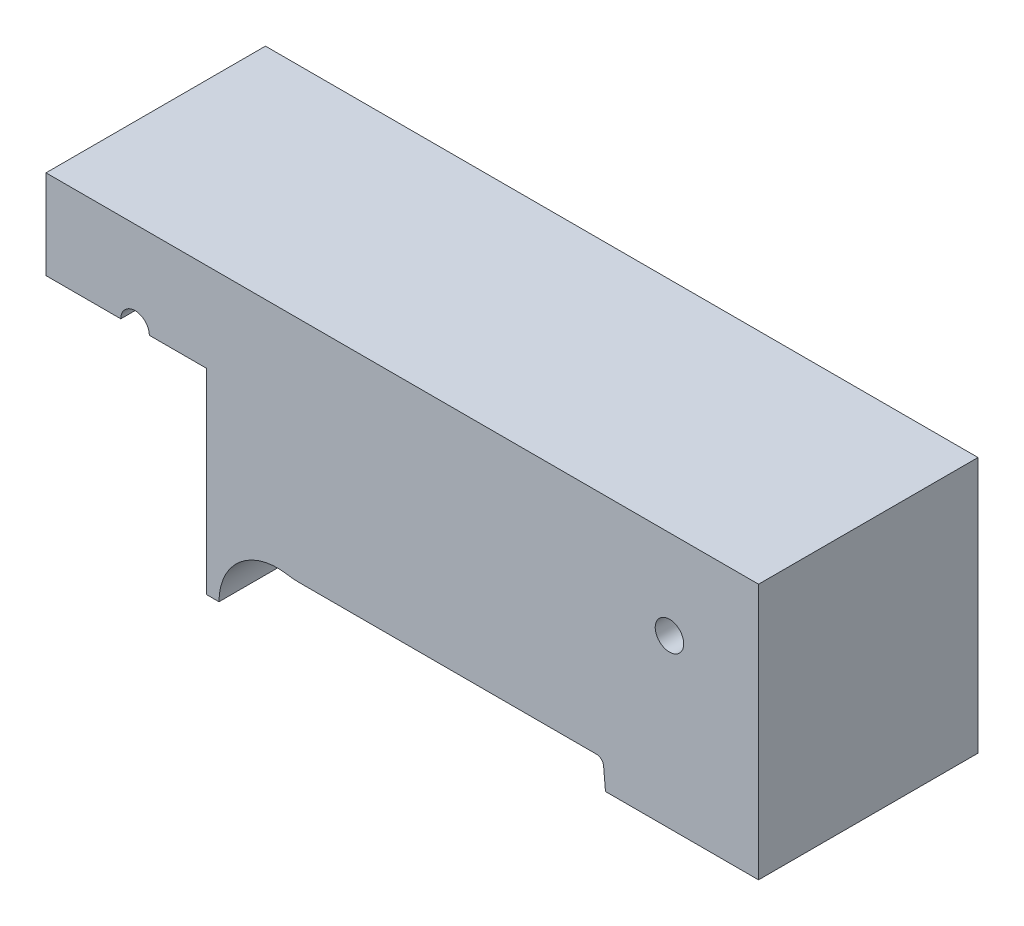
SolidWorks part; units mm, degrees
ref_plane "Plan1" through (0, 0, 0) normal (0, 0, 1) x (1, 0, 0)
ref_plane "Plan2" through (0, 0, 0) normal (0, 1, 0) x (1, 0, 0)
ref_plane "Plan3" through (0, 0, 0) normal (1, 0, 0) x (0, 0, -1)
sketch "Esquisse1" plane through (0, 0, 0) normal (0, 0, 1) x (1, 0, 0)
  line L1 (0, 0) -> (200, 0)
  line L2 (0, 0) -> (0, 150)
  line L3 (0, 150) -> (200, 150)
  line L4 (200, 0) -> (200, 150)
  dimension "D1" = 150
  dimension "D2" = 200
extrude "Base-Extrusion" add sketch "Esquisse1" along normal blind 65
sketch "Esquisse2" plane through (0, 0, 65) normal (0, 0, 1) x (1, 0, 0)
  line L0 (-10, 70) -> (90, 70) construction
  line L1 (0, 0) -> (200, 0) construction
  line L2 (20.3045, 78.12) -> (209.4484, 78.12) construction
  line L3 (71.0782, 85.935) -> (154.4898, 85.935)
  line L4 (156.5121, 84.0819) -> (157.0337, 78.12)
  line L5 (156.5121, 72.1581) -> (157.0337, 78.12)
  line L6 (95.6814, 70.305) -> (154.4898, 70.305)
  line L7 (200, 0) -> (200, 150) construction
  arc A0 (67.7404, 86.2151) -> (78.8329, 61.1069) centre (65, 70) ccw
  arc A1 (154.4898, 85.935) -> (156.5121, 84.0819) centre (154.4898, 83.905) cw
  arc A2 (71.0782, 85.935) -> (67.7404, 86.2151) centre (71.0782, 105.965) cw
  arc A3 (154.4898, 70.305) -> (156.5121, 72.1581) centre (154.4898, 72.335) ccw
  arc A4 (95.6814, 70.305) -> (78.8329, 61.1069) centre (95.6814, 50.275) ccw
  point P13 (156.35, 85.935)
  dimension "D2" = 32.89
  dimension "D6" = 91.35
  dimension "D7" = 2.03
  dimension "D8" = 20.03
  dimension "D9" = 20.03
  dimension "D10" = 135
  dimension "D1" = 70
  dimension "D3" = 8.12
  dimension "D4" = 7.815
  dimension "D5" = 95
extrude "Enlèv. mat.-Extru.1" cut sketch "Esquisse2" against normal through all
sketch "Esquisse3" plane through (0, 0, 0) normal (0, 0, -1) x (-1, 0, 0)
  line L5 (-210.7053, 159.8634) -> (12.6195, 159.8634)
  line L6 (-210.7053, 159.8634) -> (-210.7053, -13.0538)
  line L7 (-210.7053, -13.0538) -> (12.6195, -13.0538)
  line L8 (-161.049, 78.12) -> (-160.4969, 71.8095)
  line L9 (-160.4969, 84.4305) -> (-161.049, 78.12)
  line L10 (-71.0782, 89.935) -> (-154.4898, 89.935)
  line L11 (-154.4898, 66.305) -> (-95.6814, 66.305)
  line L12 (-161.049, 78.12) -> (-160.4969, 71.8095)
  line L13 (-160.4969, 84.4305) -> (-161.049, 78.12)
  line L14 (-71.0782, 89.935) -> (-154.4898, 89.935)
  line L15 (-154.4898, 66.305) -> (-95.6814, 66.305)
  line L16 (12.6195, 159.8634) -> (12.6195, -13.0538)
  arc A10 (-160.4969, 71.8095) -> (-154.4898, 66.305) centre (-154.4898, 72.335) ccw
  arc A11 (-154.4898, 89.935) -> (-160.4969, 84.4305) centre (-154.4898, 83.905) ccw
  arc A12 (-71.0782, 89.935) -> (-68.407, 90.1591) centre (-71.0782, 105.965) ccw
  arc A13 (-82.1976, 58.9437) -> (-68.407, 90.1591) centre (-65, 70) ccw
  arc A14 (-82.1976, 58.9437) -> (-95.6814, 66.305) centre (-95.6814, 50.275) ccw
  arc A15 (-160.4969, 71.8095) -> (-154.4898, 66.305) centre (-154.4898, 72.335) ccw
  arc A16 (-154.4898, 89.935) -> (-160.4969, 84.4305) centre (-154.4898, 83.905) ccw
  arc A17 (-71.0782, 89.935) -> (-68.407, 90.1591) centre (-71.0782, 105.965) ccw
  arc A18 (-82.1976, 58.9437) -> (-68.407, 90.1591) centre (-65, 70) ccw
  arc A19 (-82.1976, 58.9437) -> (-95.6814, 66.305) centre (-95.6814, 50.275) ccw
  dimension "D1" = 4
extrude "Enlèv. mat.-Extru.2" cut sketch "Esquisse3" against normal blind 3.4
fillet "Congé1" radius 3
hole_wizard "Trou taraudé M10x1.52" positions "Esquisse9" profile "Esquisse8" tap size "M10x1.5" standard "ISO"
sketch "Esquisse9" plane through (0, 0, 65) normal (0, 0, 1) x (1, 0, 0)
  line L0 (200, 150) -> (0, 150) construction
  line L1 (200, 0) -> (200, 150) construction
  line L3 (0, 0) -> (200, 0) construction
  point P0 (25, 125)
  point P1 (175, 125)
  point P2 (175, 25)
  point P3 (25, 25)
  dimension "D1" = 150
  dimension "D2" = 150
  dimension "D3" = 100
  dimension "D4" = 100
  dimension "D5" = 25
  dimension "D6" = 25
  dimension "D7" = 25
  dimension "D8" = 25
sketch "Esquisse8" plane through (25, 125, 65) normal (1, 0, 0) x (0, -1, 0)
  line L0 (0, 0) -> (0, 45.3094)
  line L1 (0, 45.3094) -> (4, 43)
  line L2 (4, 43) -> (4, 0)
  line L5 (4, 0) -> (0, 0)
  line L10 (0, 45.3094) -> (-4, 43) construction
  line L11 (0, -6.35) -> (0, 107.95) construction
  dimension "Diamètre du perçage" = 8
  dimension "Profondeur du perçage" = 43
  dimension "Angle de pointe" = 120
sketch "Esquisse10" plane through (0, 0, 65) normal (0, 0, 1) x (1, 0, 0)
  line L0 (-8.2863, 125) -> (45, 125)
  line L1 (45, 125) -> (45, 70)
  line L2 (45, 70) -> (65, 70)
  line L3 (65, 70) -> (82.4134, 78.12)
  line L4 (82.4134, 78.12) -> (206.578, 78.12)
  line L5 (0, 150) -> (0, 0) construction
  dimension "D1" = 45
  dimension "D2" = 25
  dimension "D3" = 8.12
extrude "Enlèv. mat.-Extru.3" cut sketch "Esquisse10" against normal through all flip side to cut
